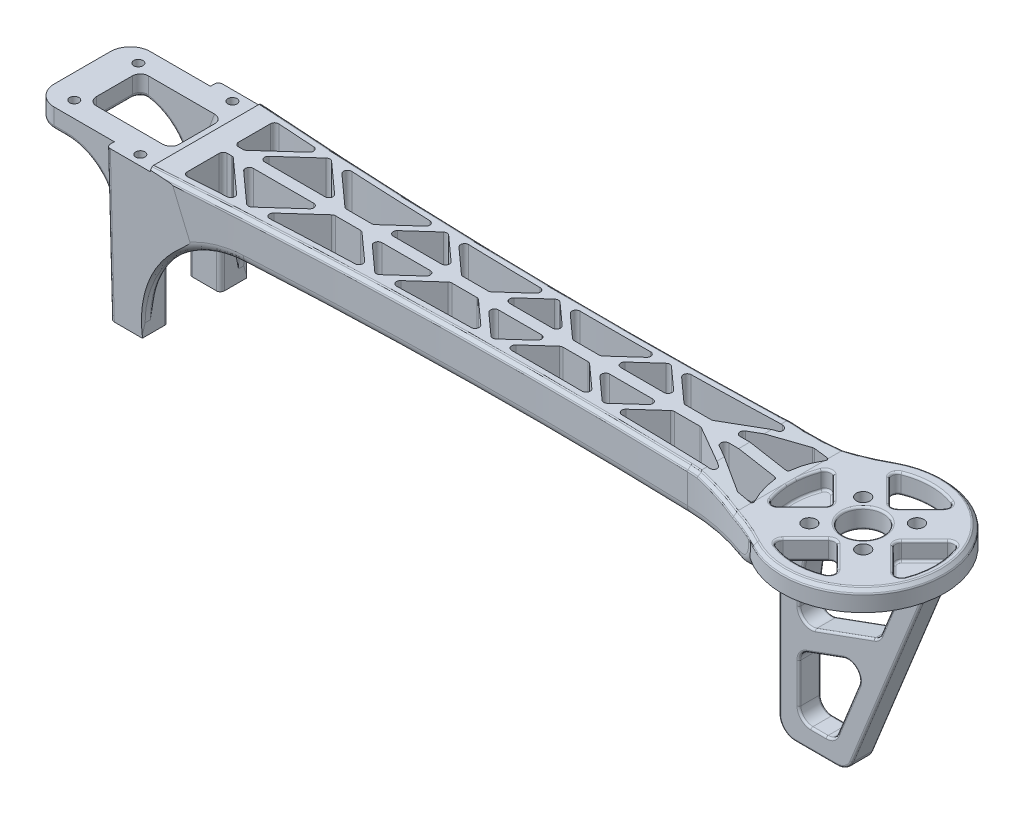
SolidWorks part; units mm, degrees
ref_plane "XY" through (0, 0, 0) normal (0, 0, 1) x (1, 0, 0)
ref_plane "XZ" through (0, 0, 0) normal (0, 1, 0) x (1, 0, 0)
ref_plane "YZ" through (0, 0, 0) normal (1, 0, 0) x (0, 0, -1)
sketch "Esquisse1" plane through (0, 0, 0) normal (0, 0, 1) x (1, 0, 0)
  line L0 (-114.5, 5.5) -> (100.5, 5.5)
  line L1 (0, 0) -> (-114.5, 0) construction
  line L2 (-114.5, -5.5) -> (-94.5, -5.5)
  line L3 (-114.5, -5.5) -> (-114.5, 5.5)
  line L4 (100.5, -5.5) -> (100.5, 5.5)
  line L9 (-94.5, -5.5) -> (-94.5, -33.5)
  line L10 (-94.5, -33.5) -> (-86.5, -33.5)
  line L11 (-86.5, -33.5) -> (-86.5, -5.5)
  line L12 (-86.5, -5.5) -> (100.5, -5.5)
  dimension "D1" = 11
  dimension "D2" = 114.5
  dimension "D6" = 8
  dimension "D7" = 39
  dimension "D8" = 20
  dimension "D9" = 215
extrude "Boss.-Extru.1" add sketch "Esquisse1" along normal mid plane 26
sketch "Esquisse4" plane through (0, 5.5, 0) normal (0, 1, 0) x (1, 0, 0)
  line L0 (-114.5, -13) -> (-114.5, 13) construction
  line L1 (-122.1117, 34.7299) -> (-83.5, 34.7299)
  line L2 (-122.1117, 34.7299) -> (-122.1117, -54.5072)
  line L3 (-122.1117, -54.5072) -> (-83.5, -54.5072)
  line L4 (-83.5, 34.7299) -> (-83.5, -54.5072)
  dimension "D1" = 31
extrude "Enlèv. mat.-Extru.4" cut sketch "Esquisse4" against normal blind 1
fillet "Congé4" radius 25 1 edges at (-86.5, -5.5, 0)
sketch "Esquisse5" plane through (0, -5.5, 0) normal (0, -1, 0) x (1, 0, 0)
  line L0 (-94.5, 13) -> (-94.5, -13) construction
  line L1 (-125.9764, -43.5688) -> (-94.5, -43.5688)
  line L2 (-125.9764, -43.5688) -> (-125.9764, 44.4392)
  line L3 (-125.9764, 44.4392) -> (-94.5, 44.4392)
  line L4 (-94.5, -43.5688) -> (-94.5, 44.4392)
extrude "Enlèv. mat.-Extru.5" cut sketch "Esquisse5" against normal blind 5
sketch "Esquisse6" plane through (0, 0, 0) normal (1, 0, 0) x (0, 0, -1)
  line L0 (-13, -33.5) -> (13, -33.5) construction
  line L1 (6.5, -33.5) -> (-6.5, -33.5)
  line L2 (6.5, -33.5) -> (6.5, -21.5)
  line L4 (-6.5, -33.5) -> (-6.5, -21.5)
  line L5 (0, 4.5) -> (0, -33.5) construction
  line L6 (13, 4.5) -> (-13, 4.5) construction
  arc A0 (6.5, -21.5) -> (-6.5, -21.5) centre (0, -21.5) ccw
  dimension "D2" = 12
  dimension "D1" = 13
extrude "Enlèv. mat.-Extru.6" cut sketch "Esquisse6" against normal through all
sketch "Esquisse7" plane through (0, 4.5, 0) normal (0, 1, 0) x (1, 0, 0)
  line L1 (-114.5, 13) -> (-94.5, 13)
  line L2 (-114.5, 13) -> (-114.5, 12)
  line L3 (-114.5, 12) -> (-94.5, 12)
  line L4 (-94.5, 13) -> (-94.5, 12)
  line L5 (-114.5, -13) -> (-94.5, -13)
  line L6 (-114.5, -13) -> (-114.5, -12)
  line L7 (-114.5, -12) -> (-94.5, -12)
  line L8 (-94.5, -13) -> (-94.5, -12)
  dimension "D1" = 1
  dimension "D2" = 1
extrude "Enlèv. mat.-Extru.7" cut sketch "Esquisse7" against normal up to surface (5 mm away)
draft "Dépouille5" type of draft neutral plane draft angle 1.5 faces to draft 1 parameters "D1"=1.5
draft "Dépouille6" type of draft neutral plane draft angle 1.5 faces to draft 1 parameters "D1"=1.5
sketch "Esquisse8" plane through (0, 4.5, 0) normal (0, 1, 0) x (1, 0, 0)
  line L0 (-114.5, 12) -> (-94.5, 12) construction
  line L1 (-104.5, 6.5) -> (-85.5, 6.5)
  line L2 (-106.5, 4.5) -> (-106.5, -4.5)
  line L3 (-104.5, -6.5) -> (-85.5, -6.5)
  line L4 (-85.5, 6.5) -> (-85.5, -6.5)
  line L5 (-114.5, 12) -> (-114.5, -12) construction
  arc A2 (-106.5, -4.5) -> (-104.5, -6.5) centre (-104.5, -4.5) ccw
  arc A3 (-104.5, 6.5) -> (-106.5, 4.5) centre (-104.5, 4.5) ccw
  point P6 (-114.5, 0)
  point P15 (-106.5, -6.5)
  point P18 (-106.5, 6.5)
  dimension "D5" = 2
  dimension "D1" = 13
  dimension "D2" = 5.5
  dimension "D3" = 21
  dimension "D4" = 8
extrude "Enlèv. mat.-Extru.8" cut sketch "Esquisse8" against normal through all
draft "Dépouille7" type of draft neutral plane draft angle 20 faces to draft 1 parameters "D1"=20
sketch "Esquisse10" plane through (-114.5, 0, 0) normal (-1, 0, 0) x (0, 0, 1)
  line L0 (-12, -0.5) -> (12, -0.5) construction
  line L1 (-6.5, -0.5) -> (6.5, -0.5)
  line L2 (-6.5, -0.5) -> (-6.5, -43.4644)
  line L3 (-6.5, -43.4644) -> (6.5, -43.4644)
  line L4 (6.5, -0.5) -> (6.5, -43.4644)
  line L6 (-6.5, -33.5) -> (-6.5, -21.5) construction
  line L7 (6.5, -21.5) -> (6.5, -33.5) construction
extrude "Enlèv. mat.-Extru.10" cut sketch "Esquisse10" against normal blind 25
fillet "Congé9" radius 2 4 edges at (-89.5, -13.495, 6.5) (-89.5, -13.495, -6.5) (-87.682, -0.495, 6.5) (-87.682, -0.495, -6.5)
fillet "Congé11" radius 2 3 edges at (-90.0858, -5.3866, 5.9142) (-90.0858, -5.3866, -5.9142) (-89.5, -5.4899, 0)
fillet "Congé12" radius 12 2 edges at (-94.5, -0.5, -9.25) (-94.5, -0.5, 9.25)
fillet "Congé13" radius 5 2 edges at (-114.5, 2, -12) (-114.5, 2, 12)
fillet "Congé14" radius 1 7 edges at (-98.0147, -4.0147, -12) (-108, -0.5, -12) (-113.0355, -0.5, -10.5355) (-114.5, -0.5, 0) (-113.0355, -0.5, 10.5355) (-108, -0.5, 12) (-98.0147, -4.0147, 12)
fillet "Congé15" radius 1 8 edges at (-94.5, -14.5, 13.4975) (-94.5, -23, 6.5) (-106.062, -0.508, -5.7491) (-97.3348, -4.754, -6.5) (-97.3348, -4.754, 6.5) (-105.7418, -0.524, 6.0678) (-94.5, -23, -6.5) (-94.5, -14.5, -13.4975)
fillet "Congé16" radius 1 3 edges at (-89.683, -17.7879, -5.3358) (-89.683, -17.7879, 5.3358) (-89.5, -15, 0)
sketch "Esquisse11" plane through (-86.5, 0, 0) normal (1, 0, 0) x (0, 0, -1)
  line L0 (-13, -33.5) -> (-6.5, -33.5) construction
  line L1 (-10, -33.5) -> (10, -33.5)
  line L2 (-10, -33.5) -> (-10, -7.5)
  line L3 (-10, -7.5) -> (10, -7.5)
  line L4 (10, -33.5) -> (10, -7.5)
  line L5 (0, -33.5) -> (0, -21.5) construction
  dimension "D1" = 26
  dimension "D2" = 20
extrude "Enlèv. mat.-Extru.11" cut sketch "Esquisse11" along normal blind 46
fillet "Congé17" radius 1 6 edges at (-86.5, -27.5, -6.5) (-86.5, -27.5, 6.5) (-86.5, -7.5, 0) (-82.356, -16.715, -10) (-82.356, -16.715, 10) (-86.5, -15, 0)
sketch "Esquisse12" plane through (0, 5.5, 0) normal (0, 1, 0) x (1, 0, 0)
  line L0 (-199.7214, 0) -> (216.7214, 0) construction
  line L1 (8.5, 11) -> (8.5, 0) construction
  line L2 (-83.5, -14.0213) -> (-83.5, 14.0213) construction
  circle A0 centre (8.5, 1261) radius 1250
  circle A1 centre (8.5, -1261) radius 1250
  point P4 (8.5, -11)
  point P5 (8.5, 11)
  dimension "D1" = 2500
  dimension "D2" = 2500
  dimension "D3" = 22
  dimension "D4" = 11
  dimension "D5" = 92
extrude "Enlèv. mat.-Extru.12" cut sketch "Esquisse12" against normal through all
sketch "Esquisse14" plane through (0, 5.5, 0) normal (0, 1, 0) x (-1, 0, 0)
  line L0 (114.5, -7) -> (114.5, 7) construction
  circle A0 centre (-80.5, 0) radius 20.3
  point P2 (114.5, 0)
  dimension "D1" = 40.6
  dimension "D2" = 195
extrude "Boss.-Extru.2" add sketch "Esquisse14" against normal blind 7
sketch "Esquisse15" plane through (0, 5.5, 0) normal (0, 1, 0) x (1, 0, 0)
  line L0 (87.714, 18.9749) -> (90.4721, 26.2296)
  line L1 (87.714, -18.9749) -> (95.5805, -23.6646)
  arc A0 (87.714, -18.9749) -> (87.714, 18.9749) centre (80.5, 0) ccw
  arc A1 (95.5805, -23.6646) -> (90.4721, 26.2296) centre (80.5, 0) ccw
extrude "Enlèv. mat.-Extru.13" cut sketch "Esquisse15" against normal through all
sketch "Esquisse17" plane through (0, -5.5, 0) normal (0, -1, 0) x (1, 0, 0)
  line L0 (71.5, 18.1959) -> (71.5, -18.1959)
  arc A0 (64.3101, -12.2465) -> (64.3101, 12.2465) centre (80.5, 0) ccw construction
  arc A1 (71.5, -18.1959) -> (71.5, 18.1959) centre (80.5, 0) ccw
  dimension "D1" = 9
extrude "Enlèv. mat.-Extru.14" cut sketch "Esquisse17" against normal up to surface (4 mm away)
sketch "Esquisse18" plane through (0, 5.5, 0) normal (0, 1, 0) x (1, 0, 0)
  circle A0 centre (80.5, 0) radius 20.3
  arc A1 (64.3101, -12.2465) -> (64.3101, 12.2465) centre (80.5, 0) ccw construction
extrude "Enlèv. mat.-Extru.15" cut sketch "Esquisse18" against normal blind 2
fillet "Congé18" radius 7 1 edges at (71.5, -5.5, 0)
sketch "Esquisse16" plane through (0, 0, 0) normal (0, 0, 1) x (1, 0, 0)
  line L0 (62.2067, -1.5) -> (62.2067, -49.5)
  line L2 (62.2067, -49.5) -> (79.4067, -49.5)
  line L3 (79.4067, -49.5) -> (98.8, -1.5)
  line L5 (64.3101, 5.5) -> (-78.3562, 5.5) construction
  line L6 (62.2067, -1.5) -> (67.2067, -1.5)
  line L7 (70.2067, -44.5) -> (74.0107, -44.5)
  line L8 (76.7922, -42.6238) -> (82.1372, -29.3945)
  line L9 (69.1807, -28.7815) -> (78.3296, -25.4516)
  line L10 (67.2067, -31.6006) -> (67.2067, -41.5)
  line L11 (93.4073, -1.5) -> (98.8, -1.5)
  line L12 (93.4073, -1.5) -> (87.6821, -15.6704)
  line L13 (85.9266, -17.3656) -> (71.2328, -22.7137)
  line L14 (67.2067, -19.8947) -> (67.2067, -1.5)
  line L15 (64.3101, -1.5) -> (100.8, -1.5) construction
  arc A0 (70.2067, -44.5) -> (67.2067, -41.5) centre (70.2067, -41.5) cw
  arc A1 (74.0107, -44.5) -> (76.7922, -42.6238) centre (74.0107, -41.5) ccw
  arc A2 (82.1372, -29.3945) -> (78.3296, -25.4516) centre (79.3557, -28.2707) ccw
  arc A3 (69.1807, -28.7815) -> (67.2067, -31.6006) centre (70.2067, -31.6006) ccw
  arc A4 (71.2328, -22.7137) -> (67.2067, -19.8947) centre (70.2067, -19.8947) cw
  arc A5 (87.6821, -15.6704) -> (85.9266, -17.3656) centre (84.9006, -14.5465) cw
  point P17 (67.2067, -44.5)
  point P27 (67.2067, -29.5)
  dimension "D13" = 3
  dimension "D1" = 17.2
  dimension "D2" = 68
  dimension "D3" = 55
  dimension "D4" = 5
  dimension "D5" = 5
  dimension "D6" = 5
  dimension "D7" = 5
  dimension "D8" = 110
  dimension "D9" = 5
  dimension "D10" = 5
  dimension "D11" = 2
  dimension "D12" = 15
extrude "Boss.-Extru.3" add sketch "Esquisse16" along normal mid plane 5.5
fillet "Congé19" radius 1 4 edges at (66.2022, -5.4243, -2.75) (63.6911, -5.5, -2.75) (66.2022, -5.4243, 2.75) (63.6911, -5.5, 2.75)
fillet "Congé20" radius 3 2 edges at (98.8, -1.5, 0) (62.2067, -5.5, 0)
fillet "Congé21" radius 45 1 edges at (67.2067, -5.1988, 0)
fillet "Congé22" radius 4 2 edges at (79.4067, -49.5, 0) (62.2067, -49.5, 0)
fillet "Congé23" radius 0.5 16 edges at (67.7493, -29.8799, -2.75) (73.7551, -27.1166, -2.75) (81.5137, -26.1867, -2.75) (79.4647, -36.0092, -2.75) (75.6883, -43.9871, -2.75) (72.1087, -44.5, -2.75) (68.0854, -43.6213, -2.75) (67.7493, -29.8799, 2.75) (73.7551, -27.1166, 2.75) (81.5137, -26.1867, 2.75) (79.4647, -36.0092, 2.75) (75.6883, -43.9871, 2.75) (72.1087, -44.5, 2.75) (68.0854, -43.6213, 2.75) (67.2067, -36.5503, -2.75) (67.2067, -36.5503, 2.75)
fillet "Congé26" radius 0.5 6 edges at (70.699, -3.2993, 3.0193) (90.5447, -8.5852, 2.75) (86.9845, -16.7046, 2.75) (68.486, -22.3521, 2.75) (68.0043, -12.2256, 2.75) (78.5797, -20.0397, 2.75)
fillet "Congé27" radius 0.5 6 edges at (70.699, -3.2993, -3.0193) (68.486, -22.3521, -2.75) (78.5797, -20.0397, -2.75) (86.9845, -16.7046, -2.75) (68.0043, -12.2256, -2.75) (90.5447, -8.5852, -2.75)
fillet "Congé28" radius 0.5 16 edges at (60.4025, -5.7486, 3.0901) (62.0093, -7.4295, 2.75) (62.2067, -27, 2.75) (63.3783, -48.3284, 2.75) (71.4577, -49.5, 2.75) (78.9455, -48.8162, 2.75) (99.3567, -1.8772, 2.75) (60.4025, -5.7486, -3.0901) (62.0093, -7.4295, -2.75) (62.2067, -27, -2.75) (63.3783, -48.3284, -2.75) (71.4577, -49.5, -2.75) (78.9455, -48.8162, -2.75) (98.7904, -2.2893, -2.75) (89.2312, -25.1836, 2.75) (89.2312, -25.1836, -2.75)
sketch "Esquisse19" plane through (0, 0, 0) normal (0, 0, 1) x (1, 0, 0)
  line L2 (100.8, 3.5) -> (64.3101, 3.5) construction
  line L3 (50.8, 8.4876) -> (71.7324, 8.4876)
  line L5 (50.8, 8.4876) -> (50.8, 3.5)
  line L6 (50.8, 3.5) -> (71.7324, 3.5)
  line L7 (71.7324, 8.4876) -> (71.7324, 3.5)
  dimension "D1" = 50
extrude "Enlèv. mat.-Extru.16" cut sketch "Esquisse19" against normal mid plane 100
draft "Dépouille8" type of draft neutral plane draft angle 80 faces to draft 1 parameters "D1"=80
fillet "Congé33" radius 50 2 edges at (64.3101, 1, -12.2465) (64.3101, 1, 12.2465)
chamfer "Chanfrein1" distance 1 angle 45 9 edges at (49.5134, 5.5, -11.689) (-15.0959, 5.5, -11.2227) (49.5134, 5.5, 11.689) (-15.0959, 5.5, 11.2227) (56.5378, 4.4883, -12.5964) (66.519, 3.5, 15.7295) (66.519, 3.5, -15.7295) (100.8, 3.5, 0) (56.5378, 4.4883, 12.5964)
fillet "Congé34" radius 0.5 18 edges at (49.5293, 5.5, 10.6883) (-14.9071, 4.5, 11.2192) (-17.658, 5.5, 10.2735) (-14.9071, 4.5, -11.2192) (-17.658, 5.5, -10.2735) (100.8, 2.5, 0) (49.5293, 5.5, -10.6883) (99.8, 3.5, 0)
sketch "Esquisse20" plane through (0, 0, 0) normal (0, 0, 1) x (1, 0, 0)
  line L0 (-61.5, -5.5) -> (65.1754, -5.5) construction
  line L1 (48.2249, -1.5) -> (70.7213, -1.5) construction
  line L2 (48.2249, -5.5) -> (65.1754, -5.5)
  line L3 (48.2249, -1.5) -> (71.5, -1.5)
  line L4 (48.2249, -1.5) -> (48.2249, -5.5)
  arc A0 (65.1754, -5.5) -> (71.5, -1.5) centre (65.1754, 1.5) ccw construction
  arc A1 (65.1754, -5.5) -> (71.5, -1.5) centre (65.1754, 1.5) ccw
extrude "Boss.-Extru.4" add sketch "Esquisse20" along normal mid plane 40
sketch "Esquisse21" plane through (0, -1.5, 0) normal (0, 1, 0) x (1, 0, 0)
  line L0 (71.5, 18.1959) -> (71.5, 20) construction
  line L1 (71.5, 20) -> (48.2249, 20) construction
  line L2 (48.2249, 11.6314) -> (48.2249, 20) construction
  line L3 (71.5, 18.1959) -> (71.5, 20)
  line L4 (71.5, 20) -> (48.2249, 20)
  line L5 (48.2249, 11.6314) -> (48.2249, 20)
  line L9 (48.2249, -11.6314) -> (48.2249, -20)
  line L10 (48.2249, -20) -> (71.5, -20)
  line L11 (71.5, -20) -> (71.5, -18.1959)
  line L12 (48.2249, -11.6314) -> (48.2249, -20)
  line L13 (48.2249, -20) -> (71.5, -20)
  line L14 (71.5, -20) -> (71.5, -18.1959)
  arc A0 (48.2249, 11.6314) -> (70.7213, 17.7895) centre (46.6359, 61.6061) ccw construction
  arc A1 (48.2249, 11.6314) -> (70.7213, 17.7895) centre (46.6359, 61.6061) ccw
  arc A2 (71.5, 18.1959) -> (70.7213, 17.7895) centre (80.5, 0) ccw construction
  arc A3 (71.5, 18.1959) -> (70.7213, 17.7895) centre (80.5, 0) ccw
  arc A6 (70.7213, -17.7895) -> (71.5, -18.1959) centre (80.5, 0) ccw
  arc A7 (70.7213, -17.7895) -> (48.2249, -11.6314) centre (46.6359, -61.6061) ccw
  arc A8 (70.7213, -17.7895) -> (71.5, -18.1959) centre (80.5, 0) ccw
  arc A9 (70.7213, -17.7895) -> (48.2249, -11.6314) centre (46.6359, -61.6061) ccw
  dimension "D1" = 0
extrude "Enlèv. mat.-Extru.17" cut sketch "Esquisse21" against normal through all
sketch "Esquisse22" plane through (0, 5.5, 0) normal (0, 1, 0) x (1, 0, 0)
  line L0 (80.5, 0) -> (85.5, 0) construction
  line L1 (80.5, 0) -> (86.0861, 5.5861) construction
  line L2 (80.5, 0) -> (80.5, 5) construction
  line L3 (80.5, 0) -> (73.9946, 6.5054) construction
  line L4 (73.7706, 13.2581) -> (79.4393, 7.5893)
  line L5 (81.5607, 7.5893) -> (87.2294, 13.2581)
  line L6 (72.2687, 14.76) -> (88.7313, 14.76) construction
  line L7 (81.5607, -7.5893) -> (87.2294, -13.2581)
  line L8 (73.7706, -13.2581) -> (79.4393, -7.5893)
  line L9 (72.2687, -14.76) -> (88.7313, -14.76) construction
  circle A0 centre (80.5, 0) radius 5
  circle A3 centre (86.1569, -5.6569) radius 1.7
  circle A4 centre (86.1569, -5.6569) radius 1.7
  arc A5 (86.7209, 15.7134) -> (74.2791, 15.7134) centre (80.5, 0) ccw
  arc A6 (70.7213, -17.7895) -> (70.7213, 17.7895) centre (80.5, 0) ccw construction
  arc A7 (79.4393, 7.5893) -> (81.5607, 7.5893) centre (80.5, 8.65) ccw
  arc A8 (73.7706, 13.2581) -> (74.2791, 15.7134) centre (74.8313, 14.3187) cw
  arc A9 (87.2294, 13.2581) -> (86.7209, 15.7134) centre (86.1687, 14.3187) ccw
  arc A10 (79.4393, -7.5893) -> (81.5607, -7.5893) centre (80.5, -8.65) cw
  arc A11 (87.2294, -13.2581) -> (86.7209, -15.7134) centre (86.1687, -14.3187) cw
  arc A12 (73.7706, -13.2581) -> (74.2791, -15.7134) centre (74.8313, -14.3187) ccw
  arc A13 (86.7209, -15.7134) -> (74.2791, -15.7134) centre (80.5, 0) cw
  circle A15 centre (73.7825, -6.7175) radius 1.7
  circle A16 centre (73.7825, -6.7175) radius 1.7
  circle A23 centre (74.8431, 5.6569) radius 1.7
  circle A24 centre (74.8431, 5.6569) radius 1.7
  circle A26 centre (87.2175, 6.7175) radius 1.7
  circle A27 centre (87.2175, 6.7175) radius 1.7
  point P22 (80.5, 7.15)
  dimension "D1" = 10
  dimension "D3" = 0.2
  dimension "D6" = 0.2
  dimension "D8" = 3.4
  dimension "D12" = 1.5
  dimension "D2" = 45
  dimension "D4" = 7.9
  dimension "D5" = 45
  dimension "D7" = 0.2
  dimension "D9" = 45
  dimension "D10" = 45
  dimension "D11" = 2.15
  dimension "D13" = 0.2
extrude "Enlèv. mat.-Extru.18" cut sketch "Esquisse22" against normal up to surface (7 mm away)
sketch "Esquisse23" plane through (0, 5.5, 0) normal (0, 1, 0) x (1, 0, 0)
  line L0 (96.3389, 8.3389) -> (96.3389, -8.3389) construction
  line L1 (94.8017, 6.8017) -> (89.0607, 1.0607)
  line L2 (89.0607, -1.0607) -> (94.8017, -6.8017)
  line L3 (80.5, 22.3468) -> (80.5, -21.1046) construction
  line L4 (64.6611, 8.3389) -> (64.6611, -8.3389) construction
  line L5 (71.9393, -1.0607) -> (66.1983, -6.8017)
  line L6 (66.1983, 6.8017) -> (71.9393, 1.0607)
  arc A0 (97.2674, -6.2661) -> (97.2674, 6.2661) centre (80.5, 0) ccw
  arc A1 (70.7213, -17.7895) -> (70.7213, 17.7895) centre (80.5, 0) ccw construction
  arc A2 (94.8017, -6.8017) -> (97.2674, -6.2661) centre (95.8623, -5.741) ccw
  arc A3 (89.0607, 1.0607) -> (89.0607, -1.0607) centre (90.1213, 0) ccw
  arc A4 (94.8017, 6.8017) -> (97.2674, 6.2661) centre (95.8623, 5.741) cw
  arc A5 (66.1983, 6.8017) -> (63.7326, 6.2661) centre (65.1377, 5.741) ccw
  arc A6 (71.9393, 1.0607) -> (71.9393, -1.0607) centre (70.8787, 0) cw
  arc A7 (66.1983, -6.8017) -> (63.7326, -6.2661) centre (65.1377, -5.741) cw
  arc A8 (63.7326, -6.2661) -> (63.7326, 6.2661) centre (80.5, 0) cw
  point P12 (88, 0)
  point P29 (73, 0)
  dimension "D1" = 2.4
  dimension "D5" = 1.5
  dimension "D2" = 90
  dimension "D3" = 45
  dimension "D4" = 7.5
extrude "Enlèv. mat.-Extru.19" cut sketch "Esquisse23" against normal offset from surface (6.5 mm away) 0.5
fillet "Congé40" radius 0.5 50 edges at (87.6375, -1.5, -14.6229) (80.5, -1.5, -16.9) (73.3625, -1.5, -14.6229) (76.605, -1.5, -10.4237) (80.5, -1.5, -7.15) (80.5, -1.5, 7.15) (76.605, -1.5, 10.4237) (73.3625, -1.5, 14.6229) (80.5, -1.5, 16.9) (87.6375, -1.5, 14.6229) (80.5, 3.5, 7.15) (84.395, 3.5, 10.4237) (84.395, -1.5, 10.4237) (87.6375, 3.5, 14.6229) (80.5, 3.5, 16.9) (73.3625, 3.5, 14.6229) (80.5, 3.5, -7.15) (73.3625, 3.5, -14.6229) (80.5, 3.5, -16.9) (87.6375, 3.5, -14.6229) (96.1807, 3.5, -7.2068) (96.1807, -1, -7.2068) (98.4, 3.5, 0) (98.4, -1, 0) (96.1807, 3.5, 7.2068) (96.1807, -1, 7.2068) (91.9312, 3.5, 3.9312) (91.9312, -1, 3.9312) (88.6213, 3.5, 0) (88.6213, -1, 0) (72.3787, 3.5, 0) (72.3787, -1, 0) (69.0688, 3.5, 3.9312) (69.0688, -1, 3.9312) (64.8193, 3.5, 7.2068) (64.8193, -1, 7.2068) (62.6, 3.5, 0) (62.6, -1, 0) (64.8193, 3.5, -7.2068) (64.8193, -1, -7.2068) (75.5, 3.5, 0) (75.5, -1.5, 0) (84.395, -1.5, -10.4237) (76.605, 3.5, 10.4237) (76.605, 3.5, -10.4237) (84.395, 3.5, -10.4237) (91.9312, 3.5, -3.9312) (91.9312, -1, -3.9312) (69.0688, 3.5, -3.9312) (69.0688, -1, -3.9312)
sketch "Esquisse24" plane through (0, 5.5, 0) normal (0, 1, 0) x (1, 0, 0)
  line L0 (-83.5, 0) -> (8.5, 0) construction
  line L1 (53.7285, 6.662) -> (45.1036, 1.6824) construction
  line L2 (-83.5, -13.9951) -> (-83.5, 13.9951) construction
  line L3 (48.3465, 1.4) -> (59.787, 1.4)
  line L4 (58.439, 9.3816) -> (47.8465, 3.266)
  line L5 (51.7, 7.3615) -> (41.6065, 1.534)
  line L6 (34.0892, 1.6569) -> (28.2405, 6.923)
  line L7 (30.0174, 3.1431) -> (24.6312, 7.993)
  line L8 (23.2929, 7.993) -> (17.9066, 3.1431)
  line L9 (13.8349, 1.6569) -> (19.5467, 6.7998)
  line L10 (6.2644, 1.6569) -> (0.5769, 6.7778)
  line L11 (2.1926, 3.1431) -> (-3.155, 7.9581)
  line L12 (-4.4932, 7.9581) -> (-9.8408, 3.1431)
  line L13 (-13.9126, 1.6569) -> (-8.1161, 6.876)
  line L14 (-21.4831, 1.6569) -> (-27.7068, 7.2607)
  line L15 (-25.5549, 3.1431) -> (-31.5712, 8.5603)
  line L16 (-32.9095, 8.5603) -> (-38.9258, 3.1431)
  line L17 (-36.4127, 7.5859) -> (-42.9975, 1.6569)
  line L18 (-50.5681, 1.6569) -> (-58.1629, 8.4953)
  line L19 (-54.6398, 3.1431) -> (-62.1788, 9.9313)
  line L20 (52.9185, 8.0649) -> (44.2936, 3.0854) construction
  line L21 (58.8973, 9.5147) -> (61.7929, 9.6354)
  line L22 (-76.9, 1.4) -> (-75.797, 1.4)
  line L23 (-70.387, -1.4) -> (-55.3089, -1.4)
  line L24 (-63.5171, 9.9313) -> (-71.0561, 3.1431)
  line L25 (-75.1279, 1.6569) -> (-66.898, 9.067)
  line L26 (-77.9, 2.4) -> (-77.9, 10.4125)
  line L27 (34.7583, 1.4) -> (41.1065, 1.4)
  line L28 (18.5758, 1.4) -> (29.3483, 1.4)
  line L29 (6.9335, 1.4) -> (13.1658, 1.4)
  line L30 (-9.1717, 1.4) -> (1.5235, 1.4)
  line L31 (-20.814, 1.4) -> (-14.5817, 1.4)
  line L32 (-38.2567, 1.4) -> (-26.224, 1.4)
  line L33 (-49.8989, 1.4) -> (-43.6667, 1.4)
  line L34 (-70.387, 1.4) -> (-55.3089, 1.4)
  line L35 (-49.8989, -1.4) -> (-43.6667, -1.4)
  line L36 (-38.2567, -1.4) -> (-26.224, -1.4)
  line L37 (-20.814, -1.4) -> (-14.5817, -1.4)
  line L38 (-9.1717, -1.4) -> (1.5235, -1.4)
  line L39 (6.9335, -1.4) -> (13.1658, -1.4)
  line L40 (18.5758, -1.4) -> (29.3483, -1.4)
  line L41 (34.7583, -1.4) -> (41.1065, -1.4)
  line L42 (-77.9, -2.4) -> (-77.9, -10.4125)
  line L43 (-75.1279, -1.6569) -> (-66.898, -9.067)
  line L44 (-63.5171, -9.9313) -> (-71.0561, -3.1431)
  line L45 (-76.9, -1.4) -> (-75.797, -1.4)
  line L46 (58.8973, -9.5147) -> (61.7929, -9.6354)
  line L47 (-54.6398, -3.1431) -> (-62.1788, -9.9313)
  line L48 (-50.5681, -1.6569) -> (-58.1629, -8.4953)
  line L49 (-36.4127, -7.5859) -> (-42.9975, -1.6569)
  line L50 (-32.9095, -8.5603) -> (-38.9258, -3.1431)
  line L51 (-25.5549, -3.1431) -> (-31.5712, -8.5603)
  line L52 (-21.4831, -1.6569) -> (-27.7068, -7.2607)
  line L53 (-13.9126, -1.6569) -> (-8.1161, -6.876)
  line L54 (-4.4932, -7.9581) -> (-9.8408, -3.1431)
  line L55 (2.1926, -3.1431) -> (-3.155, -7.9581)
  line L56 (6.2644, -1.6569) -> (0.5769, -6.7778)
  line L57 (13.8349, -1.6569) -> (19.5467, -6.7998)
  line L58 (23.2929, -7.993) -> (17.9066, -3.1431)
  line L59 (30.0174, -3.1431) -> (24.6312, -7.993)
  line L60 (34.0892, -1.6569) -> (28.2405, -6.923)
  line L61 (51.7, -7.3615) -> (41.6065, -1.534)
  line L62 (58.439, -9.3816) -> (47.8465, -3.266)
  line L63 (48.3465, -1.4) -> (59.787, -1.4)
  circle A0 centre (8.5, 1261) radius 1250 construction
  arc A1 (97.1314, 11.6399) -> (95.1907, 14.0097) centre (80.5, 0) ccw
  arc A2 (-77.9012, 13.9896) -> (48.2249, 11.6314) centre (8.5, 1261) ccw construction
  arc A3 (-76.8319, 11.4102) -> (-67.5065, 10.8083) centre (8.5, 1261) ccw
  arc A4 (70.7213, -17.7895) -> (70.7213, 17.7895) centre (80.5, 0) ccw construction
  arc A5 (62.2629, 8.9162) -> (60.2849, 1.8543) centre (80.5, 0) ccw
  arc A6 (59.787, 1.4) -> (60.2849, 1.8543) centre (59.787, 1.9) ccw
  arc A7 (61.7929, 9.6354) -> (62.2629, 8.9162) centre (61.8137, 9.1358) cw
  arc A8 (58.439, 9.3816) -> (58.8973, 9.5147) centre (58.939, 8.5156) cw
  arc A9 (48.3465, 1.4) -> (47.8465, 3.266) centre (48.3465, 2.4) cw
  arc A10 (58.8716, 9.5133) -> (61.8253, 9.6357) centre (8.5, 1261) ccw
  circle A11 centre (8.5, 1261) radius 1252.5 construction
  arc A12 (28.8933, 8.666) -> (51.1659, 9.2269) centre (8.5, 1261) ccw
  arc A13 (1.2518, 8.521) -> (18.8693, 8.5429) centre (8.5, 1261) ccw
  arc A14 (-27.0094, 9.0035) -> (-8.7714, 8.6191) centre (8.5, 1261) ccw
  arc A15 (-57.4411, 10.237) -> (-37.0454, 9.3284) centre (8.5, 1261) ccw
  arc A16 (51.7, 7.3615) -> (51.1659, 9.2269) centre (51.2, 8.2275) ccw
  arc A17 (41.6065, 1.534) -> (41.1065, 1.4) centre (41.1065, 2.4) cw
  arc A18 (34.0892, 1.6569) -> (34.7583, 1.4) centre (34.7583, 2.4) ccw
  arc A19 (28.2405, 6.923) -> (28.8933, 8.666) centre (28.9096, 7.6662) cw
  arc A20 (24.6312, 7.993) -> (23.2929, 7.993) centre (23.962, 7.2498) ccw
  arc A21 (30.0174, 3.1431) -> (29.3483, 1.4) centre (29.3483, 2.4) cw
  arc A22 (17.9066, 3.1431) -> (18.5758, 1.4) centre (18.5758, 2.4) ccw
  arc A23 (19.5467, 6.7998) -> (18.8693, 8.5429) centre (18.8776, 7.543) ccw
  arc A24 (13.8349, 1.6569) -> (13.1658, 1.4) centre (13.1658, 2.4) cw
  arc A25 (6.2644, 1.6569) -> (6.9335, 1.4) centre (6.9335, 2.4) ccw
  arc A26 (0.5769, 6.7778) -> (1.2518, 8.521) centre (1.2461, 7.521) cw
  arc A27 (2.1926, 3.1431) -> (1.5235, 1.4) centre (1.5235, 2.4) cw
  arc A28 (-9.8408, 3.1431) -> (-9.1717, 1.4) centre (-9.1717, 2.4) ccw
  arc A29 (-3.155, 7.9581) -> (-4.4932, 7.9581) centre (-3.8241, 7.215) ccw
  arc A30 (-8.1161, 6.876) -> (-8.7714, 8.6191) centre (-8.7852, 7.6192) ccw
  arc A31 (-13.9126, 1.6569) -> (-14.5817, 1.4) centre (-14.5817, 2.4) cw
  arc A32 (-21.4831, 1.6569) -> (-20.814, 1.4) centre (-20.814, 2.4) ccw
  arc A33 (-27.7068, 7.2607) -> (-27.0094, 9.0035) centre (-27.0377, 8.0039) cw
  arc A34 (-31.5712, 8.5603) -> (-32.9095, 8.5603) centre (-32.2403, 7.8171) ccw
  arc A35 (-25.5549, 3.1431) -> (-26.224, 1.4) centre (-26.224, 2.4) cw
  arc A36 (-38.9258, 3.1431) -> (-38.2567, 1.4) centre (-38.2567, 2.4) ccw
  arc A37 (-36.4127, 7.5859) -> (-37.0454, 9.3284) centre (-37.0818, 8.329) ccw
  arc A38 (-42.9975, 1.6569) -> (-43.6667, 1.4) centre (-43.6667, 2.4) cw
  arc A39 (-50.5681, 1.6569) -> (-49.8989, 1.4) centre (-49.8989, 2.4) ccw
  arc A40 (-58.1629, 8.4953) -> (-57.4411, 10.237) centre (-57.4938, 9.2384) cw
  arc A41 (-54.6398, 3.1431) -> (-55.3089, 1.4) centre (-55.3089, 2.4) cw
  arc A42 (-62.1788, 9.9313) -> (-63.5171, 9.9313) centre (-62.848, 9.1882) ccw
  arc A43 (-71.0561, 3.1431) -> (-70.387, 1.4) centre (-70.387, 2.4) ccw
  arc A44 (-75.1279, 1.6569) -> (-75.797, 1.4) centre (-75.797, 2.4) cw
  arc A45 (-77.9, 2.4) -> (-76.9, 1.4) centre (-76.9, 2.4) ccw
  arc A46 (-77.9, 10.4125) -> (-76.8319, 11.4102) centre (-76.9, 10.4125) cw
  arc A47 (-66.898, 9.067) -> (-67.5065, 10.8083) centre (-67.5672, 9.8102) ccw
  arc A48 (-66.898, -9.067) -> (-67.5065, -10.8083) centre (-67.5672, -9.8102) cw
  arc A49 (-77.9, -10.4125) -> (-76.8319, -11.4102) centre (-76.9, -10.4125) ccw
  arc A50 (-77.9, -2.4) -> (-76.9, -1.4) centre (-76.9, -2.4) cw
  arc A51 (-75.1279, -1.6569) -> (-75.797, -1.4) centre (-75.797, -2.4) ccw
  arc A52 (-71.0561, -3.1431) -> (-70.387, -1.4) centre (-70.387, -2.4) cw
  arc A53 (-62.1788, -9.9313) -> (-63.5171, -9.9313) centre (-62.848, -9.1882) cw
  arc A54 (-54.6398, -3.1431) -> (-55.3089, -1.4) centre (-55.3089, -2.4) ccw
  arc A55 (-58.1629, -8.4953) -> (-57.4411, -10.237) centre (-57.4938, -9.2384) ccw
  arc A56 (-50.5681, -1.6569) -> (-49.8989, -1.4) centre (-49.8989, -2.4) cw
  arc A57 (-42.9975, -1.6569) -> (-43.6667, -1.4) centre (-43.6667, -2.4) ccw
  arc A58 (-36.4127, -7.5859) -> (-37.0454, -9.3284) centre (-37.0818, -8.329) cw
  arc A59 (-38.9258, -3.1431) -> (-38.2567, -1.4) centre (-38.2567, -2.4) cw
  arc A60 (-25.5549, -3.1431) -> (-26.224, -1.4) centre (-26.224, -2.4) ccw
  arc A61 (-31.5712, -8.5603) -> (-32.9095, -8.5603) centre (-32.2403, -7.8171) cw
  arc A62 (-27.7068, -7.2607) -> (-27.0094, -9.0035) centre (-27.0377, -8.0039) ccw
  arc A63 (-21.4831, -1.6569) -> (-20.814, -1.4) centre (-20.814, -2.4) cw
  arc A64 (-13.9126, -1.6569) -> (-14.5817, -1.4) centre (-14.5817, -2.4) ccw
  arc A65 (-8.1161, -6.876) -> (-8.7714, -8.6191) centre (-8.7852, -7.6192) cw
  arc A66 (-3.155, -7.9581) -> (-4.4932, -7.9581) centre (-3.8241, -7.215) cw
  arc A67 (-9.8408, -3.1431) -> (-9.1717, -1.4) centre (-9.1717, -2.4) cw
  arc A68 (2.1926, -3.1431) -> (1.5235, -1.4) centre (1.5235, -2.4) ccw
  arc A69 (0.5769, -6.7778) -> (1.2518, -8.521) centre (1.2461, -7.521) ccw
  arc A70 (6.2644, -1.6569) -> (6.9335, -1.4) centre (6.9335, -2.4) cw
  arc A71 (13.8349, -1.6569) -> (13.1658, -1.4) centre (13.1658, -2.4) ccw
  arc A72 (19.5467, -6.7998) -> (18.8693, -8.5429) centre (18.8776, -7.543) cw
  arc A73 (17.9066, -3.1431) -> (18.5758, -1.4) centre (18.5758, -2.4) cw
  arc A74 (30.0174, -3.1431) -> (29.3483, -1.4) centre (29.3483, -2.4) ccw
  arc A75 (24.6312, -7.993) -> (23.2929, -7.993) centre (23.962, -7.2498) cw
  arc A76 (28.2405, -6.923) -> (28.8933, -8.666) centre (28.9096, -7.6662) ccw
  arc A77 (34.0892, -1.6569) -> (34.7583, -1.4) centre (34.7583, -2.4) cw
  arc A78 (41.6065, -1.534) -> (41.1065, -1.4) centre (41.1065, -2.4) ccw
  arc A79 (51.7, -7.3615) -> (51.1659, -9.2269) centre (51.2, -8.2275) cw
  arc A80 (-57.4411, -10.237) -> (-37.0454, -9.3284) centre (8.5, -1261) cw
  arc A81 (-27.0094, -9.0035) -> (-8.7714, -8.6191) centre (8.5, -1261) cw
  arc A82 (1.2518, -8.521) -> (18.8693, -8.5429) centre (8.5, -1261) cw
  arc A83 (28.8933, -8.666) -> (51.1659, -9.2269) centre (8.5, -1261) cw
  arc A84 (58.8716, -9.5133) -> (61.8253, -9.6357) centre (8.5, -1261) cw
  arc A85 (48.3465, -1.4) -> (47.8465, -3.266) centre (48.3465, -2.4) ccw
  arc A86 (58.439, -9.3816) -> (58.8973, -9.5147) centre (58.939, -8.5156) ccw
  arc A87 (61.7929, -9.6354) -> (62.2629, -8.9162) centre (61.8137, -9.1358) ccw
  arc A88 (59.787, -1.4) -> (60.2849, -1.8543) centre (59.787, -1.9) cw
  arc A89 (62.2629, -8.9162) -> (60.2849, -1.8543) centre (80.5, 0) cw
  arc A90 (-76.8319, -11.4102) -> (-67.5065, -10.8083) centre (8.5, -1261) cw
  arc A91 (97.1314, -11.6399) -> (95.1907, -14.0097) centre (80.5, 0) cw
  point P56 (62.6518, 9.6712)
  point P59 (58.6518, 9.5045)
  point P70 (1261, 1261)
  point P74 (41.3744, 1.4)
  point P77 (34.3744, 1.4)
  point P80 (26.3478, 8.6272)
  point P85 (31.9534, 1.4)
  point P88 (15.9707, 1.4)
  point P93 (13.5496, 1.4)
  point P96 (6.5496, 1.4)
  point P99 (-1.379, 8.539)
  point P102 (4.1286, 1.4)
  point P105 (-11.7768, 1.4)
  point P108 (-3.8241, 8.5606)
  point P113 (-14.1979, 1.4)
  point P116 (-21.1979, 1.4)
  point P119 (-29.7314, 9.0836)
  point P124 (-23.6189, 1.4)
  point P127 (-40.8617, 1.4)
  point P132 (-43.2828, 1.4)
  point P135 (-50.2828, 1.4)
  point P138 (-60.2663, 10.3892)
  point P141 (-52.7038, 1.4)
  point P144 (-62.848, 10.5338)
  point P147 (-72.9921, 1.4)
  dimension "D1" = 2500
  dimension "D3" = 2.5
  dimension "D8" = 0.5
  dimension "D9" = 1
  dimension "D31" = 1
  dimension "D2" = 92
  dimension "D4" = 1.4
  dimension "D5" = 1.62
  dimension "D6" = 30
  dimension "D7" = 4
  dimension "D10" = 1.62
  dimension "D11" = 1.62
  dimension "D12" = 1.62
  dimension "D13" = 1.62
  dimension "D14" = 7
  dimension "D15" = 138
  dimension "D16" = 42
  dimension "D17" = 138
  dimension "D18" = 42
  dimension "D19" = 7
  dimension "D20" = 7
  dimension "D21" = 138
  dimension "D22" = 1.62
  dimension "D23" = 42
  dimension "D24" = 1.62
  dimension "D25" = 7
  dimension "D26" = 138
  dimension "D27" = 1.62
  dimension "D28" = 42
  dimension "D29" = 1.62
  dimension "D30" = 5.6
extrude "Enlèv. mat.-Extru.20" cut sketch "Esquisse24" against normal offset from surface (9 mm away) 2 contours A26 L10 A25 L29 A24 L9 A23 A13 | L11 A29 L12 A28 L30 A27 | A33 L14 A32 L31 A31 L13 A30 A14 | A62 A81 A65 L53 A64 L37 A63 L52 | A61 L51 A60 L36 A59 L50 | L16 A36 L32 A35 L15 A34 | A55 A80 A58 L49 A57 L35 A56 L48 | A40 L18 A39 L33 A38 L17 A37 A15 | A69 A82 A72 L57 A71 L39 A70 L56 | L55 A68 L38 A67 L54 A66 | A19 L6 A18 L27 A17 L5 A12 M6 | L8 A22 L28 A21 L7 A20 | A75 L59 A74 L40 A73 L58 | A76 A83 L61 A78 L41 A77 L60 M6 | A87 A89 A88 L63 L62 A86 A84 M6 | A10 A8 L4 L3 A6 A5 A7 M6 | L47 A54 L23 A52 L44 A53 | L24 A43 L34 A41 L19 A42 | L25 A47 A3 A46 L26 A45 L22 A44 | A49 A90 A48 L43 A51 L45 A50 L42 | A9 L3 L4 M6 | L63 A85 L62 M6 | L5 A16 A12 M6 | A83 A79 L61 M6
sketch "Esquisse26" plane through (0, 5.5, 0) normal (0, 1, 0) x (1, 0, 0)
  line L0 (-75.1279, 1.6569) -> (-66.898, 9.067) construction
  line L1 (-77.9, 10.4125) -> (-77.9, 2.4) construction
  line L2 (-76.9, 1.4) -> (-75.797, 1.4) construction
  line L3 (-63.5171, 9.9313) -> (-71.0561, 3.1431) construction
  line L4 (-70.387, 1.4) -> (-55.3089, 1.4) construction
  line L5 (-54.6398, 3.1431) -> (-62.1788, 9.9313) construction
  line L6 (-58.1629, 8.4953) -> (-50.5681, 1.6569) construction
  line L7 (-49.8989, 1.4) -> (-43.6667, 1.4) construction
  line L8 (-42.9975, 1.6569) -> (-36.4127, 7.5859) construction
  line L9 (-62.1788, -9.9313) -> (-54.6398, -3.1431) construction
  line L10 (-55.3089, -1.4) -> (-70.387, -1.4) construction
  line L11 (-71.0561, -3.1431) -> (-63.5171, -9.9313) construction
  line L12 (-66.898, -9.067) -> (-75.1279, -1.6569) construction
  line L13 (-75.797, -1.4) -> (-76.9, -1.4) construction
  line L14 (-77.9, -2.4) -> (-77.9, -10.4125) construction
  line L15 (-36.4127, -7.5859) -> (-42.9975, -1.6569) construction
  line L16 (-43.6667, -1.4) -> (-49.8989, -1.4) construction
  line L17 (-50.5681, -1.6569) -> (-58.1629, -8.4953) construction
  line L18 (-32.9095, 8.5603) -> (-38.9258, 3.1431) construction
  line L19 (-38.2567, 1.4) -> (-26.224, 1.4) construction
  line L20 (-25.5549, 3.1431) -> (-31.5712, 8.5603) construction
  line L21 (-38.9258, -3.1431) -> (-32.9095, -8.5603) construction
  line L22 (-31.5712, -8.5603) -> (-25.5549, -3.1431) construction
  line L23 (-26.224, -1.4) -> (-38.2567, -1.4) construction
  line L24 (-8.1161, -6.876) -> (-13.9126, -1.6569) construction
  line L25 (-14.5817, -1.4) -> (-20.814, -1.4) construction
  line L26 (-21.4831, -1.6569) -> (-27.7068, -7.2607) construction
  line L27 (-27.7068, 7.2607) -> (-21.4831, 1.6569) construction
  line L28 (-20.814, 1.4) -> (-14.5817, 1.4) construction
  line L29 (-13.9126, 1.6569) -> (-8.1161, 6.876) construction
  line L30 (2.1926, 3.1431) -> (-3.155, 7.9581) construction
  line L31 (-4.4932, 7.9581) -> (-9.8408, 3.1431) construction
  line L32 (-9.1717, 1.4) -> (1.5235, 1.4) construction
  line L33 (-3.155, -7.9581) -> (2.1926, -3.1431) construction
  line L34 (1.5235, -1.4) -> (-9.1717, -1.4) construction
  line L35 (-9.8408, -3.1431) -> (-4.4932, -7.9581) construction
  line L36 (19.5467, -6.7998) -> (13.8349, -1.6569) construction
  line L37 (13.1658, -1.4) -> (6.9335, -1.4) construction
  line L38 (6.2644, -1.6569) -> (0.5769, -6.7778) construction
  line L39 (0.5769, 6.7778) -> (6.2644, 1.6569) construction
  line L40 (6.9335, 1.4) -> (13.1658, 1.4) construction
  line L41 (13.8349, 1.6569) -> (19.5467, 6.7998) construction
  line L42 (23.2929, 7.993) -> (17.9066, 3.1431) construction
  line L43 (18.5758, 1.4) -> (29.3483, 1.4) construction
  line L44 (30.0174, 3.1431) -> (24.6312, 7.993) construction
  line L45 (55.061, 7.3644) -> (55.061, 1.4)
  line L46 (55.061, -7.3644) -> (55.061, -1.4)
  line L48 (51.7, -7.3615) -> (41.6065, -1.534) construction
  line L49 (41.1065, -1.4) -> (34.7583, -1.4) construction
  line L50 (34.0892, -1.6569) -> (28.2405, -6.923) construction
  line L51 (28.2405, 6.923) -> (34.0892, 1.6569) construction
  line L52 (34.7583, 1.4) -> (41.1065, 1.4) construction
  line L53 (41.6065, 1.534) -> (51.7, 7.3615) construction
  line L54 (58.439, 9.3816) -> (47.8465, 3.266) construction
  line L55 (48.3465, 1.4) -> (59.787, 1.4) construction
  line L56 (59.787, -1.4) -> (48.3465, -1.4) construction
  line L57 (47.8465, -3.266) -> (58.439, -9.3816) construction
  line L58 (-75.1279, 1.6569) -> (-67.2094, 8.7866)
  line L59 (-77.9, 9.4788) -> (-77.9, 2.4)
  line L60 (-76.9, 1.4) -> (-75.797, 1.4)
  line L61 (-65.0938, 8.5116) -> (-71.0561, 3.1431)
  line L62 (-70.387, 1.4) -> (-55.3089, 1.4)
  line L63 (-54.6398, 3.1431) -> (-60.3445, 8.2797)
  line L64 (-56.8506, 7.3137) -> (-50.5681, 1.6569)
  line L65 (-49.8989, 1.4) -> (-43.6667, 1.4)
  line L66 (-42.9975, 1.6569) -> (-37.631, 6.4889)
  line L67 (-60.3445, -8.2797) -> (-54.6398, -3.1431)
  line L68 (-55.3089, -1.4) -> (-70.387, -1.4)
  line L69 (-71.0561, -3.1431) -> (-65.0938, -8.5116)
  line L70 (-68.0958, -7.9885) -> (-75.1279, -1.6569)
  line L71 (-75.797, -1.4) -> (-76.9, -1.4)
  line L72 (-77.9, -2.4) -> (-77.9, -8.9432)
  line L73 (-37.631, -6.4889) -> (-42.9975, -1.6569)
  line L74 (-43.6667, -1.4) -> (-49.8989, -1.4)
  line L75 (-50.5681, -1.6569) -> (-56.8506, -7.3137)
  line L76 (-34.5333, 7.0982) -> (-38.9258, 3.1431)
  line L77 (-38.2567, 1.4) -> (-26.224, 1.4)
  line L78 (-25.5549, 3.1431) -> (-29.801, 6.9664)
  line L79 (-38.9258, -3.1431) -> (-34.5333, -7.0982)
  line L80 (-29.801, -6.9664) -> (-25.5549, -3.1431)
  line L81 (-26.224, -1.4) -> (-38.2567, -1.4)
  line L82 (-9.3553, -5.7603) -> (-13.9126, -1.6569)
  line L83 (-14.5817, -1.4) -> (-20.814, -1.4)
  line L84 (-21.4831, -1.6569) -> (-26.4235, -6.1052)
  line L85 (-26.4235, 6.1052) -> (-21.4831, 1.6569)
  line L86 (-20.814, 1.4) -> (-14.5817, 1.4)
  line L87 (-13.9126, 1.6569) -> (-9.3553, 5.7603)
  line L88 (2.1926, 3.1431) -> (-1.4396, 6.4136)
  line L89 (-6.1644, 6.4534) -> (-9.8408, 3.1431)
  line L90 (-9.1717, 1.4) -> (1.5235, 1.4)
  line L91 (-1.4396, -6.4136) -> (2.1926, -3.1431)
  line L92 (1.5235, -1.4) -> (-9.1717, -1.4)
  line L93 (-9.8408, -3.1431) -> (-6.1644, -6.4534)
  line L94 (18.2853, -5.664) -> (13.8349, -1.6569)
  line L95 (13.1658, -1.4) -> (6.9335, -1.4)
  line L96 (6.2644, -1.6569) -> (1.8358, -5.6444)
  line L97 (1.8358, 5.6444) -> (6.2644, 1.6569)
  line L98 (6.9335, 1.4) -> (13.1658, 1.4)
  line L99 (13.8349, 1.6569) -> (18.2853, 5.664)
  line L100 (21.5717, 6.4432) -> (17.9066, 3.1431)
  line L101 (18.5758, 1.4) -> (29.3483, 1.4)
  line L102 (30.0174, 3.1431) -> (26.297, 6.4931)
  line L103 (17.9066, -3.1431) -> (21.5717, -6.4432)
  line L104 (26.297, -6.4931) -> (30.0174, -3.1431)
  line L105 (29.3483, -1.4) -> (18.5758, -1.4)
  line L106 (49.7523, -6.237) -> (41.6065, -1.534)
  line L107 (41.1065, -1.4) -> (34.7583, -1.4)
  line L108 (34.0892, -1.6569) -> (29.4773, -5.8094)
  line L109 (29.4773, 5.8094) -> (34.0892, 1.6569)
  line L110 (34.7583, 1.4) -> (41.1065, 1.4)
  line L111 (41.6065, 1.534) -> (49.7523, 6.237)
  line L112 (54.8296, 7.2977) -> (47.8465, 3.266)
  line L113 (48.3465, 1.4) -> (55.061, 1.4)
  line L114 (55.061, -1.4) -> (48.3465, -1.4)
  line L115 (47.8465, -3.266) -> (54.8296, -7.2977)
  line L116 (-92.86, 0) -> (106.9217, 0) construction
  arc A3 (-77.9, 2.4) -> (-76.9, 1.4) centre (-76.9, 2.4) ccw construction
  arc A4 (-75.797, 1.4) -> (-75.1279, 1.6569) centre (-75.797, 2.4) ccw construction
  arc A5 (-71.0561, 3.1431) -> (-70.387, 1.4) centre (-70.387, 2.4) ccw construction
  arc A6 (-55.3089, 1.4) -> (-54.6398, 3.1431) centre (-55.3089, 2.4) ccw construction
  arc A10 (-50.5681, 1.6569) -> (-49.8989, 1.4) centre (-49.8989, 2.4) ccw construction
  arc A11 (-43.6667, 1.4) -> (-42.9975, 1.6569) centre (-43.6667, 2.4) ccw construction
  arc A14 (-54.6398, -3.1431) -> (-55.3089, -1.4) centre (-55.3089, -2.4) ccw construction
  arc A15 (-70.387, -1.4) -> (-71.0561, -3.1431) centre (-70.387, -2.4) ccw construction
  arc A19 (-75.1279, -1.6569) -> (-75.797, -1.4) centre (-75.797, -2.4) ccw construction
  arc A20 (-76.9, -1.4) -> (-77.9, -2.4) centre (-76.9, -2.4) ccw construction
  arc A24 (-42.9975, -1.6569) -> (-43.6667, -1.4) centre (-43.6667, -2.4) ccw construction
  arc A25 (-49.8989, -1.4) -> (-50.5681, -1.6569) centre (-49.8989, -2.4) ccw construction
  arc A26 (-38.9258, 3.1431) -> (-38.2567, 1.4) centre (-38.2567, 2.4) ccw construction
  arc A27 (-26.224, 1.4) -> (-25.5549, 3.1431) centre (-26.224, 2.4) ccw construction
  arc A30 (-25.5549, -3.1431) -> (-26.224, -1.4) centre (-26.224, -2.4) ccw construction
  arc A31 (-38.2567, -1.4) -> (-38.9258, -3.1431) centre (-38.2567, -2.4) ccw construction
  arc A35 (-13.9126, -1.6569) -> (-14.5817, -1.4) centre (-14.5817, -2.4) ccw construction
  arc A36 (-20.814, -1.4) -> (-21.4831, -1.6569) centre (-20.814, -2.4) ccw construction
  arc A39 (-21.4831, 1.6569) -> (-20.814, 1.4) centre (-20.814, 2.4) ccw construction
  arc A40 (-14.5817, 1.4) -> (-13.9126, 1.6569) centre (-14.5817, 2.4) ccw construction
  arc A43 (-9.8408, 3.1431) -> (-9.1717, 1.4) centre (-9.1717, 2.4) ccw construction
  arc A44 (1.5235, 1.4) -> (2.1926, 3.1431) centre (1.5235, 2.4) ccw construction
  arc A46 (2.1926, -3.1431) -> (1.5235, -1.4) centre (1.5235, -2.4) ccw construction
  arc A47 (-9.1717, -1.4) -> (-9.8408, -3.1431) centre (-9.1717, -2.4) ccw construction
  arc A51 (13.8349, -1.6569) -> (13.1658, -1.4) centre (13.1658, -2.4) ccw construction
  arc A52 (6.9335, -1.4) -> (6.2644, -1.6569) centre (6.9335, -2.4) ccw construction
  arc A55 (6.2644, 1.6569) -> (6.9335, 1.4) centre (6.9335, 2.4) ccw construction
  arc A56 (13.1658, 1.4) -> (13.8349, 1.6569) centre (13.1658, 2.4) ccw construction
  arc A58 (17.9066, 3.1431) -> (18.5758, 1.4) centre (18.5758, 2.4) ccw construction
  arc A59 (29.3483, 1.4) -> (30.0174, 3.1431) centre (29.3483, 2.4) ccw construction
  arc A67 (41.6065, -1.534) -> (41.1065, -1.4) centre (41.1065, -2.4) ccw construction
  arc A68 (34.7583, -1.4) -> (34.0892, -1.6569) centre (34.7583, -2.4) ccw construction
  arc A71 (34.0892, 1.6569) -> (34.7583, 1.4) centre (34.7583, 2.4) ccw construction
  arc A72 (41.1065, 1.4) -> (41.6065, 1.534) centre (41.1065, 2.4) ccw construction
  arc A77 (47.8465, 3.266) -> (48.3465, 1.4) centre (48.3465, 2.4) ccw construction
  arc A81 (60.2849, -1.8543) -> (62.2629, -8.9162) centre (80.5, 0) ccw construction
  arc A83 (48.3465, -1.4) -> (47.8465, -3.266) centre (48.3465, -2.4) ccw construction
  arc A86 (-77.9, 9.4788) -> (-67.2094, 8.7866) centre (8.5, 1261) ccw
  circle A87 centre (8.5, 1261) radius 1254.5 construction
  arc A88 (-56.4901, 8.1846) -> (-37.947, 7.3601) centre (8.5, 1261) ccw
  arc A89 (-77.9, 2.4) -> (-76.9, 1.4) centre (-76.9, 2.4) ccw
  arc A90 (-75.797, 1.4) -> (-75.1279, 1.6569) centre (-75.797, 2.4) ccw
  arc A91 (-71.0561, 3.1431) -> (-70.387, 1.4) centre (-70.387, 2.4) ccw
  arc A92 (-55.3089, 1.4) -> (-54.6398, 3.1431) centre (-55.3089, 2.4) ccw
  arc A93 (-34.1817, 7.2263) -> (-30.1202, 7.0946) centre (8.5, 1261) ccw
  arc A94 (-26.0751, 6.9766) -> (-9.6826, 6.6318) centre (8.5, 1261) ccw
  arc A95 (-5.8242, 6.5818) -> (-1.7701, 6.542) centre (8.5, 1261) ccw
  arc A96 (-50.5681, 1.6569) -> (-49.8989, 1.4) centre (-49.8989, 2.4) ccw
  arc A97 (-43.6667, 1.4) -> (-42.9975, 1.6569) centre (-43.6667, 2.4) ccw
  arc A98 (21.9009, 6.5716) -> (25.9554, 6.6214) centre (8.5, 1261) ccw
  arc A99 (-64.7301, -8.6392) -> (-60.6515, -8.4074) centre (8.5, -1261) cw
  arc A100 (-54.6398, -3.1431) -> (-55.3089, -1.4) centre (-55.3089, -2.4) ccw
  arc A101 (-70.387, -1.4) -> (-71.0561, -3.1431) centre (-70.387, -2.4) ccw
  arc A102 (-34.1817, -7.2263) -> (-30.1202, -7.0946) centre (8.5, -1261) cw
  arc A104 (54.8296, -7.2977) -> (55.061, -7.3644) centre (55.0796, -6.8647) ccw
  arc A105 (-75.1279, -1.6569) -> (-75.797, -1.4) centre (-75.797, -2.4) ccw
  arc A106 (-76.9, -1.4) -> (-77.9, -2.4) centre (-76.9, -2.4) ccw
  arc A107 (-56.4901, -8.1846) -> (-37.947, -7.3601) centre (8.5, -1261) cw
  arc A109 (55.061, 7.3644) -> (54.8296, 7.2977) centre (55.0796, 6.8647) ccw
  arc A110 (-42.9975, -1.6569) -> (-43.6667, -1.4) centre (-43.6667, -2.4) ccw
  arc A111 (-49.8989, -1.4) -> (-50.5681, -1.6569) centre (-49.8989, -2.4) ccw
  arc A112 (-38.9258, 3.1431) -> (-38.2567, 1.4) centre (-38.2567, 2.4) ccw
  arc A113 (-26.224, 1.4) -> (-25.5549, 3.1431) centre (-26.224, 2.4) ccw
  arc A114 (2.1728, 6.516) -> (17.947, 6.5356) centre (8.5, 1261) ccw
  arc A115 (49.7523, 6.237) -> (49.486, 7.1697) centre (49.5023, 6.67) ccw
  arc A116 (-25.5549, -3.1431) -> (-26.224, -1.4) centre (-26.224, -2.4) ccw
  arc A117 (-38.2567, -1.4) -> (-38.9258, -3.1431) centre (-38.2567, -2.4) ccw
  arc A118 (-26.0751, -6.9766) -> (-9.6826, -6.6318) centre (8.5, -1261) cw
  arc A119 (29.4773, 5.8094) -> (29.8034, 6.6809) centre (29.8119, 6.181) cw
  arc A120 (49.486, -7.1697) -> (49.7523, -6.237) centre (49.5023, -6.67) ccw
  arc A121 (-13.9126, -1.6569) -> (-14.5817, -1.4) centre (-14.5817, -2.4) ccw
  arc A122 (-20.814, -1.4) -> (-21.4831, -1.6569) centre (-20.814, -2.4) ccw
  arc A123 (29.8034, 6.6809) -> (49.486, 7.1697) centre (8.5, 1261) ccw
  arc A125 (-21.4831, 1.6569) -> (-20.814, 1.4) centre (-20.814, 2.4) ccw
  arc A126 (-14.5817, 1.4) -> (-13.9126, 1.6569) centre (-14.5817, 2.4) ccw
  arc A128 (29.8034, -6.6809) -> (49.486, -7.1697) centre (8.5, -1261) cw
  arc A129 (-9.8408, 3.1431) -> (-9.1717, 1.4) centre (-9.1717, 2.4) ccw
  arc A130 (1.5235, 1.4) -> (2.1926, 3.1431) centre (1.5235, 2.4) ccw
  arc A131 (-5.8242, -6.5818) -> (-1.7701, -6.542) centre (8.5, -1261) cw
  arc A132 (2.1926, -3.1431) -> (1.5235, -1.4) centre (1.5235, -2.4) ccw
  arc A133 (-9.1717, -1.4) -> (-9.8408, -3.1431) centre (-9.1717, -2.4) ccw
  arc A134 (29.4773, -5.8094) -> (29.8034, -6.6809) centre (29.8119, -6.181) ccw
  arc A135 (2.1728, -6.516) -> (17.947, -6.5356) centre (8.5, -1261) cw
  arc A136 (25.9554, -6.6214) -> (26.297, -6.4931) centre (25.9624, -6.1215) ccw
  arc A137 (13.8349, -1.6569) -> (13.1658, -1.4) centre (13.1658, -2.4) ccw
  arc A138 (6.9335, -1.4) -> (6.2644, -1.6569) centre (6.9335, -2.4) ccw
  arc A139 (21.9009, -6.5716) -> (25.9554, -6.6214) centre (8.5, -1261) cw
  arc A140 (21.5717, -6.4432) -> (21.9009, -6.5716) centre (21.9063, -6.0716) ccw
  arc A141 (6.2644, 1.6569) -> (6.9335, 1.4) centre (6.9335, 2.4) ccw
  arc A142 (13.1658, 1.4) -> (13.8349, 1.6569) centre (13.1658, 2.4) ccw
  arc A143 (26.297, 6.4931) -> (25.9554, 6.6214) centre (25.9624, 6.1215) ccw
  arc A144 (17.9066, 3.1431) -> (18.5758, 1.4) centre (18.5758, 2.4) ccw
  arc A145 (29.3483, 1.4) -> (30.0174, 3.1431) centre (29.3483, 2.4) ccw
  arc A146 (21.5717, 6.4432) -> (21.9009, 6.5716) centre (21.9063, 6.0716) cw
  arc A147 (18.2853, 5.664) -> (17.947, 6.5356) centre (17.9507, 6.0356) ccw
  arc A148 (30.0174, -3.1431) -> (29.3483, -1.4) centre (29.3483, -2.4) ccw
  arc A149 (18.5758, -1.4) -> (17.9066, -3.1431) centre (18.5758, -2.4) ccw
  arc A150 (1.8358, 5.6444) -> (2.1728, 6.516) centre (2.1703, 6.016) cw
  arc A151 (17.947, -6.5356) -> (18.2853, -5.664) centre (17.9507, -6.0356) ccw
  arc A152 (1.8358, -5.6444) -> (2.1728, -6.516) centre (2.1703, -6.016) ccw
  arc A153 (41.6065, -1.534) -> (41.1065, -1.4) centre (41.1065, -2.4) ccw
  arc A154 (34.7583, -1.4) -> (34.0892, -1.6569) centre (34.7583, -2.4) ccw
  arc A155 (-1.4396, 6.4136) -> (-1.7701, 6.542) centre (-1.7742, 6.0421) ccw
  arc A156 (-5.8242, 6.5818) -> (-6.1644, 6.4534) centre (-5.8299, 6.0818) ccw
  arc A157 (34.0892, 1.6569) -> (34.7583, 1.4) centre (34.7583, 2.4) ccw
  arc A158 (41.1065, 1.4) -> (41.6065, 1.534) centre (41.1065, 2.4) ccw
  arc A159 (-1.7701, -6.542) -> (-1.4396, -6.4136) centre (-1.7742, -6.0421) ccw
  arc A160 (-6.1644, -6.4534) -> (-5.8242, -6.5818) centre (-5.8299, -6.0818) ccw
  arc A161 (-9.6826, -6.6318) -> (-9.3553, -5.7603) centre (-9.6899, -6.1318) ccw
  arc A162 (-9.3553, 5.7603) -> (-9.6826, 6.6318) centre (-9.6899, 6.1318) ccw
  arc A163 (47.8465, 3.266) -> (48.3465, 1.4) centre (48.3465, 2.4) ccw
  arc A166 (-26.4235, 6.1052) -> (-26.0751, 6.9766) centre (-26.0889, 6.4767) cw
  arc A169 (48.3465, -1.4) -> (47.8465, -3.266) centre (48.3465, -2.4) ccw
  arc A170 (-26.4235, -6.1052) -> (-26.0751, -6.9766) centre (-26.0889, -6.4767) ccw
  arc A171 (-29.801, -6.9664) -> (-30.1202, -7.0946) centre (-30.1356, -6.5948) cw
  circle A172 centre (8.5, 1261) radius 1250 construction
  arc A173 (-77.9012, 13.9896) -> (48.2249, 11.6314) centre (8.5, 1261) ccw construction
  arc A174 (-64.7301, 8.6392) -> (-60.6515, 8.4074) centre (8.5, 1261) ccw
  arc A175 (-77.3658, -9.442) -> (-68.3997, -8.8592) centre (8.5, -1261) cw
  arc A176 (-29.801, 6.9664) -> (-30.1202, 7.0946) centre (-30.1356, 6.5948) ccw
  arc A177 (-34.1817, 7.2263) -> (-34.5333, 7.0982) centre (-34.1987, 6.7266) ccw
  arc A178 (-34.5333, -7.0982) -> (-34.1817, -7.2263) centre (-34.1987, -6.7266) ccw
  arc A179 (-37.631, -6.4889) -> (-37.947, -7.3601) centre (-37.9656, -6.8605) cw
  arc A180 (-37.631, 6.4889) -> (-37.947, 7.3601) centre (-37.9656, 6.8605) ccw
  arc A181 (-56.8506, -7.3137) -> (-56.4901, -8.1846) centre (-56.516, -7.6852) ccw
  arc A182 (-56.4901, 8.1846) -> (-56.8506, 7.3137) centre (-56.516, 7.6852) ccw
  arc A183 (-60.3445, 8.2797) -> (-60.6515, 8.4074) centre (-60.6791, 7.9081) ccw
  arc A184 (-60.6515, -8.4074) -> (-60.3445, -8.2797) centre (-60.6791, -7.9081) ccw
  arc A185 (-65.0938, -8.5116) -> (-64.7301, -8.6392) centre (-64.7593, -8.14) ccw
  arc A186 (-64.7301, 8.6392) -> (-65.0938, 8.5116) centre (-64.7593, 8.14) ccw
  arc A188 (-68.0958, -7.9885) -> (-68.3997, -8.8592) centre (-68.4304, -8.3601) cw
  arc A189 (-77.3658, -9.442) -> (-77.9, -8.9432) centre (-77.4, -8.9432) cw
  point P4 (1264.5, 1261)
  point P48 (54.937, -7.3598)
  point P207 (28.5327, 6.66)
  point P230 (28.5327, -6.66)
  point P236 (21.7121, -6.5696)
  point P241 (21.7121, 6.5696)
  point P246 (0.8597, 6.5233)
  point P251 (0.8597, -6.5233)
  point P260 (-6.0194, -6.584)
  point P267 (-27.4337, 7.0147)
  point P270 (-27.4337, -7.0147)
  point P279 (-34.3834, -7.2332)
  point P282 (-36.7135, -7.315)
  point P287 (-57.8999, -8.2585)
  point P296 (-64.9386, -8.6514)
  point P307 (-77.9, 9.4788)
  dimension "D2" = 2500
  dimension "D1" = 4.5
extrude "Enlèv. mat.-Extru.21" cut sketch "Esquisse26" against normal through all
sketch "Esquisse29" plane through (0, -5.5, 0) normal (0, -1, 0) x (1, 0, 0)
  line L0 (-77.9, 8.9432) -> (-77.9, -8.9432)
  line L1 (-77.9, 8.9432) -> (-77.9, 2.4) construction
  line L2 (55.061, 6.8456) -> (55.061, -6.8456)
  line L3 (55.061, 7.3644) -> (55.061, 1.4) construction
  arc A0 (-77.3658, 9.442) -> (54.5427, 7.3452) centre (8.5, 1261) ccw
  arc A4 (-26.0751, 6.9766) -> (-9.6826, 6.6318) centre (8.5, 1261) ccw construction
  arc A5 (54.5427, -7.3452) -> (-77.3658, -9.442) centre (8.5, -1261) ccw
  arc A8 (-37.947, -7.3601) -> (-56.4901, -8.1846) centre (8.5, -1261) ccw construction
  arc A9 (55.061, -6.8456) -> (54.5427, -7.3452) centre (54.561, -6.8456) cw
  arc A10 (55.061, 6.8456) -> (54.5427, 7.3452) centre (54.561, 6.8456) ccw
  arc A11 (-77.9, -8.9432) -> (-77.3658, -9.442) centre (-77.4, -8.9432) ccw
  arc A12 (-77.9, 8.9432) -> (-77.3658, 9.442) centre (-77.4, 8.9432) cw
  point P22 (-77.9, -9.4788)
  dimension "D1" = 2509
  dimension "D2" = 2509
  dimension "D3" = 0.5
extrude "Enlèv. mat.-Extru.23" cut sketch "Esquisse29" against normal blind 1 and the other way through all
fillet "Congé86" radius 2.5 4 edges at (67.6766, -5.0379, 16.2488) (56.8546, -5.5, 12.6615) (-6.6521, -5.5, 11.0918)
fillet "Congé87" radius 2.5 8 edges at (68.8792, -4.4399, -16.8263) (56.8546, -5.5, -12.6615) (-82.8604, -17.5102, -13.4187) (-75.4514, -2.0968, -13.8223) (-6.6521, -5.5, -11.0918) (70.7213, -0.2392, -17.7895)
sketch "Esquisse31" plane through (0, 4.5, 0) normal (0, 1, 0) x (1, 0, 0)
  circle A2 centre (-88.5, 11.5) radius 1.15
  circle A3 centre (-88.5, 11.5) radius 1.15
  circle A5 centre (-108.5, 8) radius 1.15
  circle A6 centre (-108.5, 8) radius 1.15
  circle A8 centre (-108.5, -8) radius 1.15
  circle A9 centre (-108.5, -8) radius 1.15
  circle A11 centre (-88.5, -11.5) radius 1.15
  circle A12 centre (-88.5, -11.5) radius 1.15
  dimension "D1" = 0.2
  dimension "D2" = 0.2
  dimension "D3" = 0.2
  dimension "D4" = 0.2
extrude "vissage plaque dessus" cut sketch "Esquisse31" against normal up to surface (5 mm away)
sketch "Esquisse32" plane through (0, -33.5, 0) normal (0, -1, 0) x (1, 0, 0)
  circle A3 centre (-91.6888, 10.5) radius 1.05
  circle A4 centre (-91.6888, 10.5) radius 1.05
  circle A6 centre (-91.6888, -10.5) radius 1.15
  circle A7 centre (-91.6888, -10.5) radius 1.15
  dimension "D1" = 0.2
  dimension "D2" = 0.2
extrude "vissage plaque dessous" cut sketch "Esquisse32" against normal blind 5
